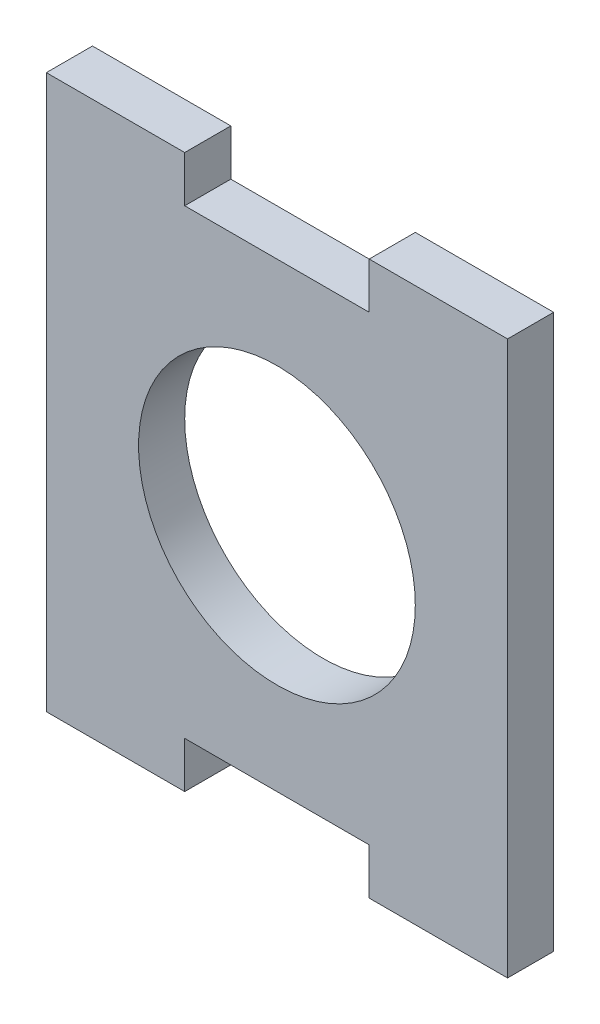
SolidWorks part; units mm, degrees
ref_plane "Plan de face" through (0, 0, 0) normal (0, 0, 1) x (1, 0, 0)
ref_plane "Plan de dessus" through (0, 0, 0) normal (0, 1, 0) x (1, 0, 0)
ref_plane "Plan de droite" through (0, 0, 0) normal (1, 0, 0) x (0, 0, -1)
sketch "Esquisse1" plane through (0, 0, 0) normal (0, 0, 1) x (1, 0, 0)
  line L0 (-5, 6) -> (-2, 6)
  line L1 (-2, 6) -> (-2, 5)
  line L2 (-2, 5) -> (2, 5)
  line L3 (2, 5) -> (2, 6)
  line L4 (2, 6) -> (5, 6)
  line L5 (5, 6) -> (5, -6)
  line L6 (5, -6) -> (2, -6)
  line L7 (2, -6) -> (2, -5)
  line L8 (2, -5) -> (-2, -5)
  line L9 (-2, -5) -> (-2, -6)
  line L10 (-2, -6) -> (-5, -6)
  line L11 (-5, -6) -> (-5, 6)
extrude "Extrusion1" add sketch "Esquisse1" along normal up to surface (1 mm away)
sketch "Esquisse2" plane through (0, 0, 1) normal (0, 0, 1) x (1, 0, 0)
  circle A0 centre (0, 0) radius 3
  dimension "D1" = 6
extrude "Enlèv. mat.-Extru.1" cut sketch "Esquisse2" against normal up to surface (1 mm away)
